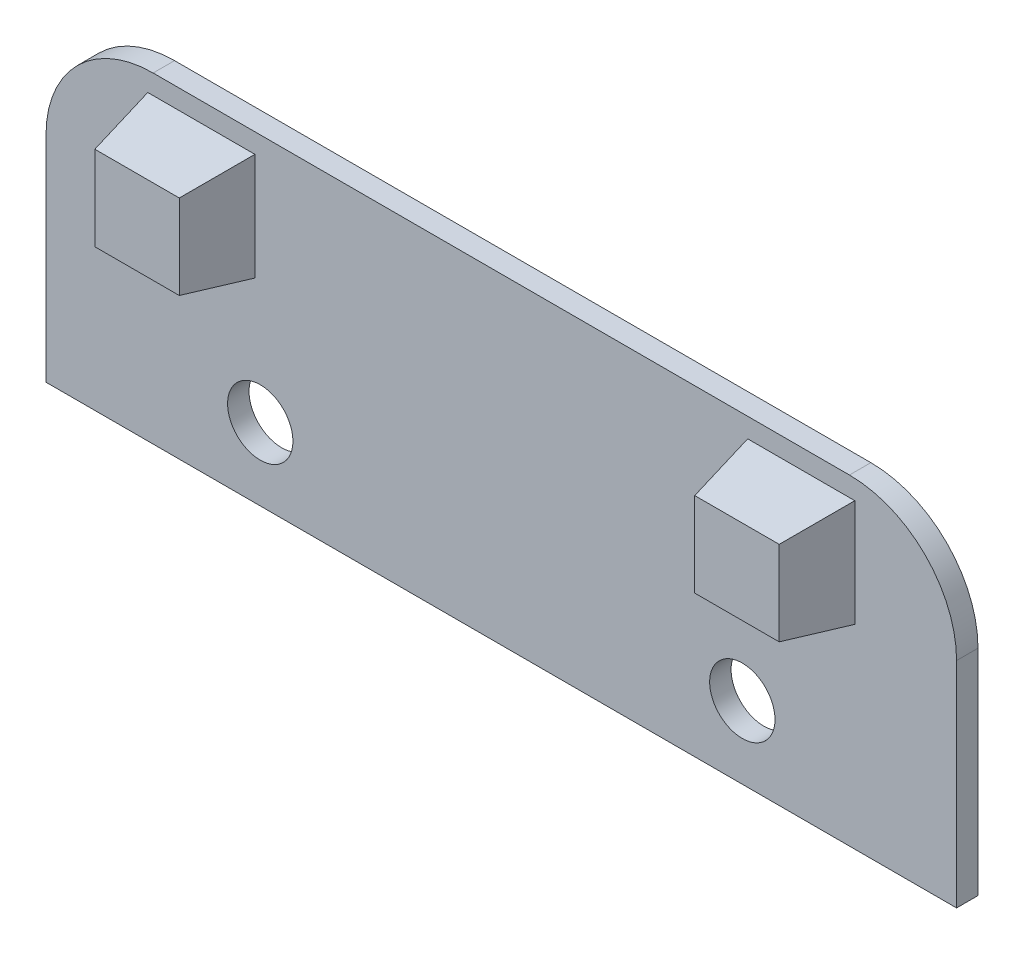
SolidWorks part; units mm, degrees
ref_plane "Plan de face" through (0, 0, 0) normal (0, 0, 1) x (1, 0, 0)
ref_plane "Plan de dessus" through (0, 0, 0) normal (0, 1, 0) x (1, 0, 0)
ref_plane "Plan de droite" through (0, 0, 0) normal (1, 0, 0) x (0, 0, -1)
sketch "Esquisse1" plane through (0, 0, 0) normal (0, 0, 1) x (1, 0, 0)
  line L1 (-85, 0) -> (85, 0)
  line L2 (-85, 0) -> (-85, 40)
  line L3 (-65, 60) -> (65, 60)
  line L4 (85, 0) -> (85, 40)
  circle A0 centre (-45, 13.5) radius 6.1
  circle A1 centre (45, 13.5) radius 6.1
  arc A2 (-85, 40) -> (-65, 60) centre (-65, 40) cw
  arc A3 (65, 60) -> (85, 40) centre (65, 40) cw
  point P11 (-85, 60)
  dimension "D4" = 20
  dimension "D5" = 12.2
  dimension "D6" = 12.2
  dimension "D7" = 40
  dimension "D8" = 40
  dimension "D1" = 170
  dimension "D2" = 85
  dimension "D3" = 60
  dimension "D9" = 13.5
extrude "Extrusion1" add sketch "Esquisse1" along normal blind 4
sketch "Esquisse2" plane through (0, 0, 4) normal (0, 0, 1) x (1, 0, 0)
  line L0 (-85, 40) -> (-85, 0) construction
  line L1 (-66, 56.35) -> (-46, 56.35)
  line L2 (-66, 56.35) -> (-66, 36.35)
  line L3 (-66, 36.35) -> (-46, 36.35)
  line L4 (-46, 56.35) -> (-46, 36.35)
  line L6 (-633, 36.35) -> (-28, 36.35) construction
  dimension "D1" = 20
  dimension "D2" = 20
  dimension "D3" = 19
extrude "Extrusion2" add sketch "Esquisse2" along normal blind 12 draft 10
mirror "Symétrie1" about plane through (0, 0, 0) normal (1, 0, 0) of "Extrusion2"
